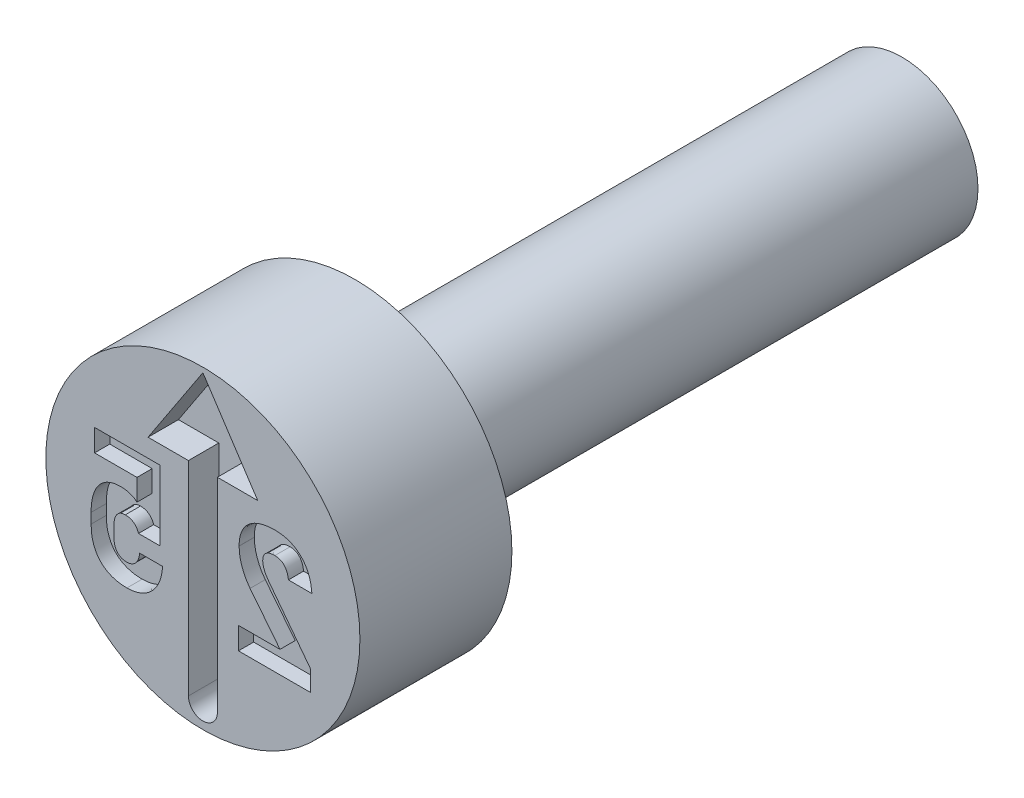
SolidWorks part; units mm, degrees
ref_plane "Front Plane" through (0, 0, 0) normal (0, 0, 1) x (1, 0, 0)
ref_plane "Top Plane" through (0, 0, 0) normal (0, 1, 0) x (1, 0, 0)
ref_plane "Right Plane" through (0, 0, 0) normal (1, 0, 0) x (0, 0, -1)
sketch "Sketch2" plane through (0, 0, 0) normal (1, 0, 0) x (0, 0, -1)
  line L0 (0.4039, 0) -> (50000.4039, 0) construction
  line L6 (0, 3.1) -> (0, 0)
  line L7 (3, 3.1) -> (0, 3.1)
  line L8 (3, 1.5) -> (3, 3.1)
  line L9 (13.8, 1.5) -> (3, 1.5)
  line L10 (13.8, 0) -> (13.8, 1.5)
  line L11 (0, 0) -> (13.8, 0)
  dimension "D1" = 6.2
  dimension "D2" = 3
  dimension "D3" = 13.8
  dimension "D4" = 3
revolve "Revolve1" add sketch "Sketch2" angle 360 about L0
sketch "Sketch3" plane through (0, 0, 0) normal (0, 0, 1) x (1, 0, 0)
  line L0 (0, 0) -> (0, 150000) construction
  line L1 (0.2857, 1.3595) -> (0.2857, -2.6642)
  line L2 (1.0829, 1.3595) -> (0.2857, 1.3595)
  line L3 (0, 3.0032) -> (1.0829, 1.3595)
  line L15 (0, 3.0032) -> (-1.0829, 1.3595)
  line L16 (-1.0829, 1.3595) -> (-0.2857, 1.3595)
  line L17 (-0.2857, 1.3595) -> (-0.2857, -2.6642)
  arc A2 (-0.2857, -2.6642) -> (0.2857, -2.6642) centre (0, -2.6642) ccw
extrude "Cut-Extrude4" cut sketch "Sketch3" against normal blind 0.6
sketch "Sketch4" plane through (0, 0, 0) normal (0, 0, 1) x (1, 0, 0)
  text T0 "2  5" font "Bahnschrift" height 2.4
  dimension "D1" = 1.4
  dimension "D2" = 2.3
extrude "Cut-Extrude5" cut sketch "Sketch4" against normal blind 0.3
